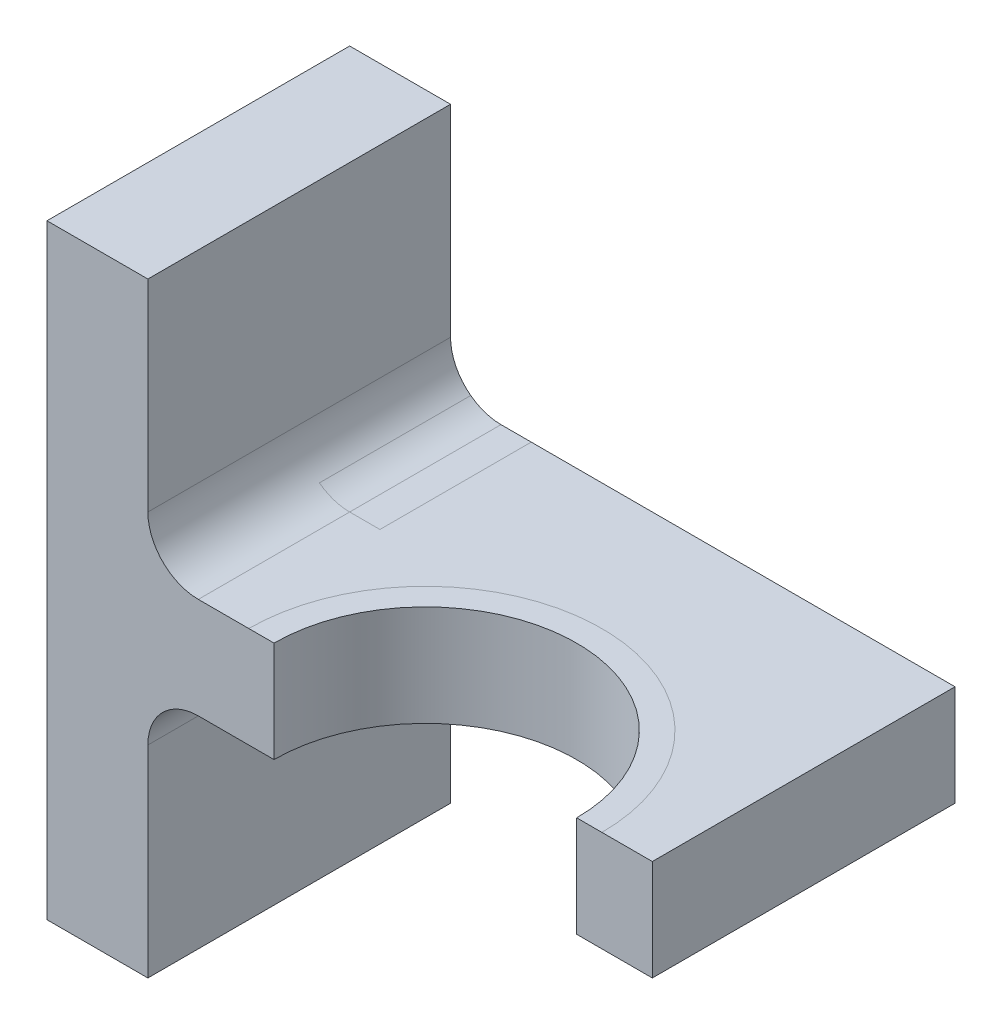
SolidWorks part; units mm, degrees
ref_plane "Front" through (0, 0, 0) normal (0, 0, 1) x (1, 0, 0)
ref_plane "Top" through (0, 0, 0) normal (0, 1, 0) x (1, 0, 0)
ref_plane "Right" through (0, 0, 0) normal (1, 0, 0) x (0, 0, -1)
sketch "Sketch1" plane through (0, 0, 0) normal (0, 0, 1) x (1, 0, 0)
  line L0 (-30.4308, 0) -> (136.341, 0) construction
  line L1 (0, -60) -> (20, -60)
  line L2 (0, -60) -> (0, 60)
  line L3 (0, 60) -> (20, 60)
  line L4 (20, -60) -> (20, -10)
  line L5 (20, -10) -> (120, -10)
  line L6 (20, 10) -> (120, 10)
  line L7 (120, 10) -> (120, -10)
  line L8 (20, 10) -> (20, 60)
  point P13 (20, 10)
  point P15 (20, -10)
  dimension "D1" = 60
  dimension "D2" = 120
  dimension "D4" = 20
  dimension "D5" = 100
extrude "Base-Extrude" add sketch "Sketch1" along normal mid plane 120
sketch "Sketch2" plane through (0, 0, 0) normal (0, 1, 0) x (-1, 0, 0)
  line L0 (-120, 60) -> (-20, 60) construction
  line L1 (-120, 60) -> (-120, -60) construction
  circle A0 centre (-75, 0) radius 30
  dimension "D1" = 60
  dimension "D3" = 45
  dimension "D2" = 60
fillet "Fillet1" radius 10 2 edges at (20, -10, 0) (20, 10, 0)
extrude "Extrude1" cut sketch "Sketch2" against normal through all and the other way through all
sketch "Sketch3" plane through (0, 10, 0) normal (0, 1, 0) x (1, 0, 0)
  circle A0 centre (75, 0) radius 35
  circle A1 centre (75, 0) radius 30 construction
  dimension "D1" = 70
fillet "fillet 2mm" [suppressed] radius 2
sketch "Sketch4" plane through (0, 0, 0) normal (0, 1, 0) x (1, 0, 0)
  line L0 (-13.1941, 0) -> (132.1397, 0)
extrude "Extrude2" cut sketch "Sketch4" against normal through all and the other way through all flip side to cut
sketch "Sketch5" plane through (0, 0, 0) normal (0, 1, 0) x (1, 0, 0)
  line L0 (120, 60) -> (30, 60) construction
  line L1 (36, 60) -> (30, 60)
  line L3 (30, 60) -> (20, 60) construction
  line L4 (30, 60) -> (24, 60)
  line L5 (24, 60) -> (24, 30)
  line L6 (24, 30) -> (36, 30)
  line L7 (36, 30) -> (36, 60)
  dimension "D1" = 30
  dimension "D2" = 6
  dimension "D3" = 12
